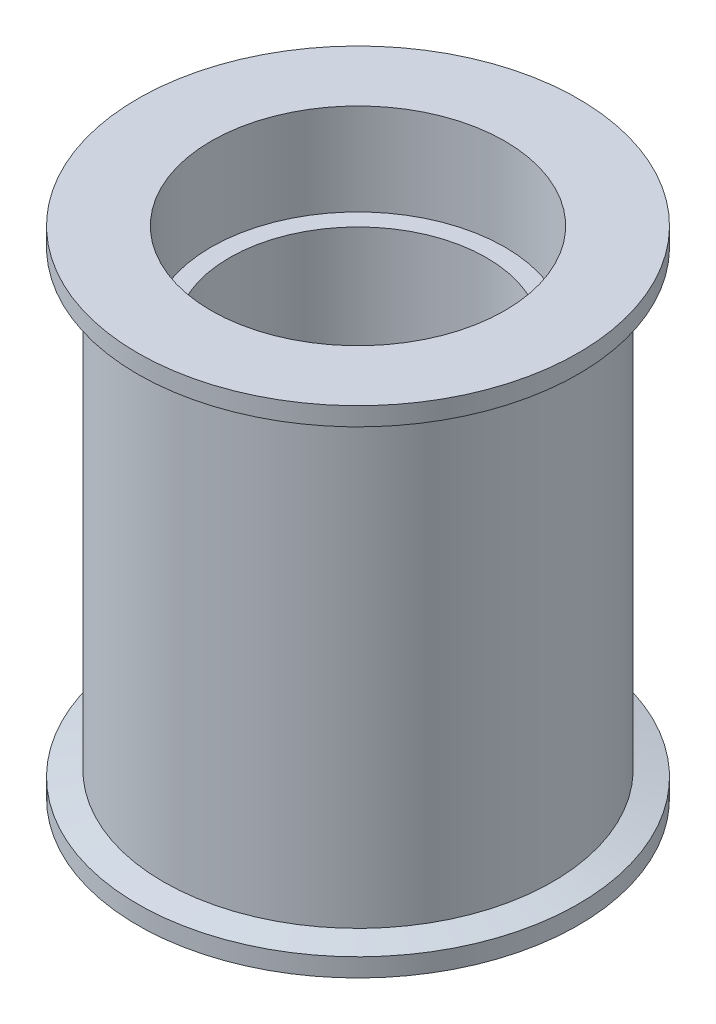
SolidWorks part; units mm, degrees
ref_plane "Спереди" through (0, 0, 0) normal (0, 0, 1) x (1, 0, 0)
ref_plane "Сверху" through (0, 0, 0) normal (0, 1, 0) x (1, 0, 0)
ref_plane "Справа" through (0, 0, 0) normal (1, 0, 0) x (0, 0, -1)
sketch "Эскиз1" plane through (0, 0, 0) normal (0, 1, 0) x (1, 0, 0)
  circle A0 centre (0, 0) radius 10.6
  dimension "D1" = 21.2
extrude "Бобышка-Вытянуть1" add sketch "Эскиз1" along normal blind 24
sketch "Эскиз2" plane through (0, 0, 0) normal (0, -1, 0) x (1, 0, 0)
  circle A0 centre (0, 0) radius 12
  dimension "D1" = 24
extrude "Бобышка-Вытянуть2" add sketch "Эскиз2" along normal blind 1.5
sketch "Эскиз3" plane through (0, 24, 0) normal (0, 1, 0) x (1, 0, 0)
  circle A0 centre (0, 0) radius 12
  dimension "D1" = 24
extrude "Бобышка-Вытянуть3" add sketch "Эскиз3" along normal blind 1.5
chamfer "Фаска1" distance 2 distance2 0.5 2 edges at (0, 0, -12) (0, 24, 12)
sketch "Эскиз4" plane through (0, -1.5, 0) normal (0, -1, 0) x (1, 0, 0)
  circle A0 centre (0, 0) radius 8
  dimension "D1" = 16
extrude "Вырез-Вытянуть1" cut sketch "Эскиз4" against normal blind 5
sketch "Эскиз5" plane through (0, 25.5, 0) normal (0, 1, 0) x (1, 0, 0)
  circle A0 centre (0, 0) radius 8
  dimension "D1" = 16
extrude "Вырез-Вытянуть2" cut sketch "Эскиз5" against normal blind 5
sketch "Эскиз6" plane through (0, 20.5, 0) normal (0, 1, 0) x (1, 0, 0)
  circle A0 centre (0, 0) radius 7
  dimension "D1" = 14
extrude "Вырез-Вытянуть3" cut sketch "Эскиз6" against normal through all
